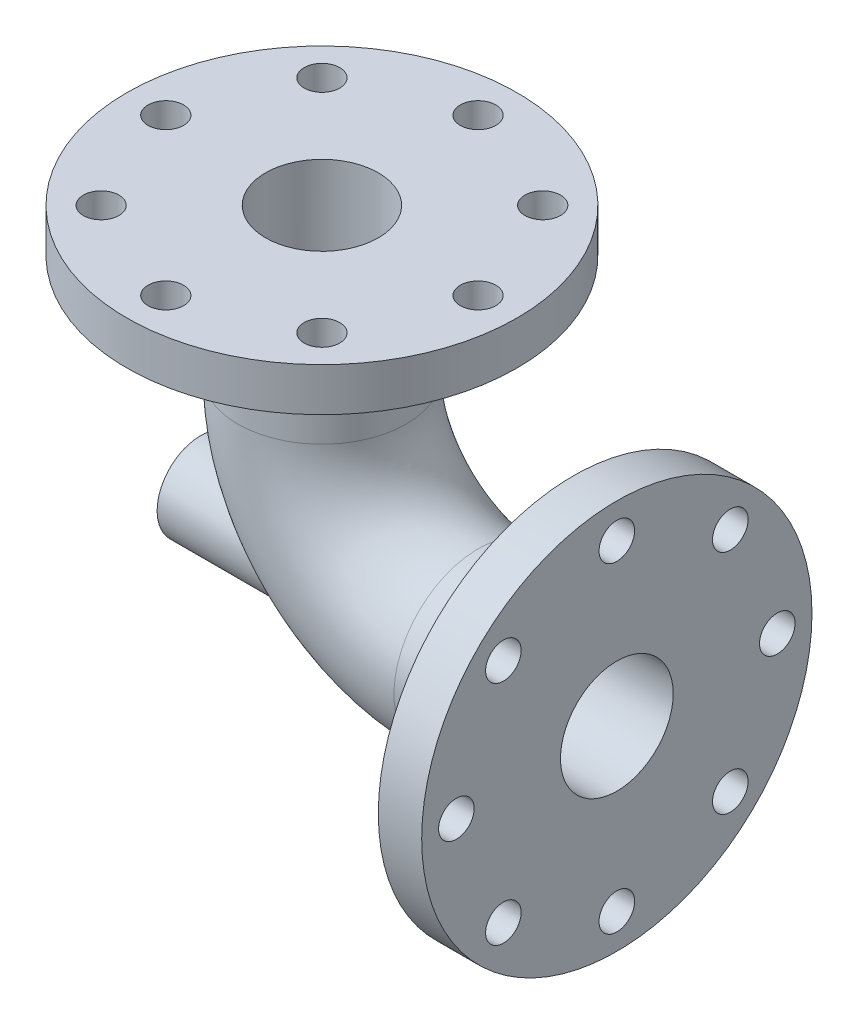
SolidWorks part; units mm, degrees
ref_plane "Front Plane" through (0, 0, 0) normal (0, 0, 1) x (1, 0, 0)
ref_plane "Top Plane" through (0, 0, 0) normal (0, 1, 0) x (1, 0, 0)
ref_plane "Right Plane" through (0, 0, 0) normal (1, 0, 0) x (0, 0, -1)
sketch "Sketch1" plane through (0, 0, 0) normal (0, 0, 1) x (1, 0, 0)
  line L0 (-90, 0) -> (-90, 85)
  line L1 (0, -90) -> (55, -90)
  arc A0 (-90, 0) -> (0, -90) centre (0, 0) ccw
  dimension "D1" = 90
  dimension "D2" = 175
  dimension "D3" = 145
ref_plane "Plane1" through (55, -90, 0) normal (1, 0, 0) x (0, 0, -1)
sketch "Sketch2" plane through (55, -90, 0) normal (1, 0, 0) x (0, 0, -1)
  circle A0 centre (0, 0) radius 48.5
  dimension "D1" = 97
sweep "Sweep-Thin1" add profiles "Sketch2" path "Sketch1" parameters "D1"=16
sketch "Sketch3" plane through (0, 85, 0) normal (0, 1, 0) x (1, 0, 0)
  circle A0 centre (-90, 0) radius 112.5
  circle A1 centre (-90, 0) radius 48.5
  dimension "D1" = 225
extrude "Boss-Extrude1" add sketch "Sketch3" against normal blind 25
other "Hole1"
sketch "Sketch4" plane through (0, 85, 0) normal (0, 1, 0) x (-1, 0, 0)
  circle A0 centre (0, 0) radius 10.25
  circle A3 centre (90, 0) radius 90 construction
  dimension "D1" = 20.5
  dimension "D2" = 180
pattern_circular "CirPattern1" count 8 over 360 about axis through (-90, 0, 0) along (0, 1, 0) of "Hole1"
sketch "Sketch5" plane through (55, 0, 0) normal (1, 0, 0) x (0, 0, -1)
  circle A0 centre (0, -90) radius 112.5
  circle A1 centre (0, -90) radius 32.5 construction
  circle A2 centre (0, -90) radius 32.5
  dimension "D1" = 225
extrude "Boss-Extrude2" add sketch "Sketch5" along normal blind 25
other "Hole2"
sketch "Sketch6" plane through (80, 0, 0) normal (1, 0, 0) x (0, 0, -1)
  circle A0 centre (92.5, -90) radius 10.25
  circle A1 centre (0, -90) radius 92.5 construction
  dimension "D1" = 20.5
  dimension "D2" = 185
pattern_circular "CirPattern2" count 8 over 360 about axis through (0, -90, 0) along (1, 0, 0) of "Hole2"
ref_plane "Plane2" through (-160, 0, 0) normal (1, 0, 0) x (0, 0, -1)
sketch "Sketch7" plane through (-160, 0, 0) normal (1, 0, 0) x (0, 0, -1)
  circle A0 centre (0, -90) radius 25
  circle A1 centre (0, -90) radius 112.5 construction
  dimension "D1" = 50
extrude "Boss-Extrude3" add sketch "Sketch7" along normal up to next
hole_wizard "CBORE for M16 Hex Head Bolt1" positions "Sketch10" profile "Sketch9" counterbore size "M16" standard "Ansi Metric"
sketch "Sketch10" plane through (-160, 0, 0) normal (-1, 0, 0) x (0, 0, 1)
  circle A0 centre (0, -90) radius 25 construction
  point P0 (0, -90)
sketch "Sketch9" plane through (-160, -90, 0) normal (0, 1, 0) x (0, 0, 1)
  line L0 (0, 0) -> (0, 76.8961)
  line L1 (0, 76.8961) -> (10, 76.8961)
  line L3 (10, 76.8961) -> (10, 28)
  line L4 (10, 28) -> (12, 28)
  line L5 (12, 28) -> (12, 0)
  line L7 (12, 0) -> (0, 0)
  line L11 (0, -6.35) -> (0, 107.95) construction
  dimension "Thru Hole Dia." = 20
  dimension "Thru Hole Depth" = 76.8961
  dimension "C'Bore Dia." = 24
  dimension "C'Bore Depth" = 28
